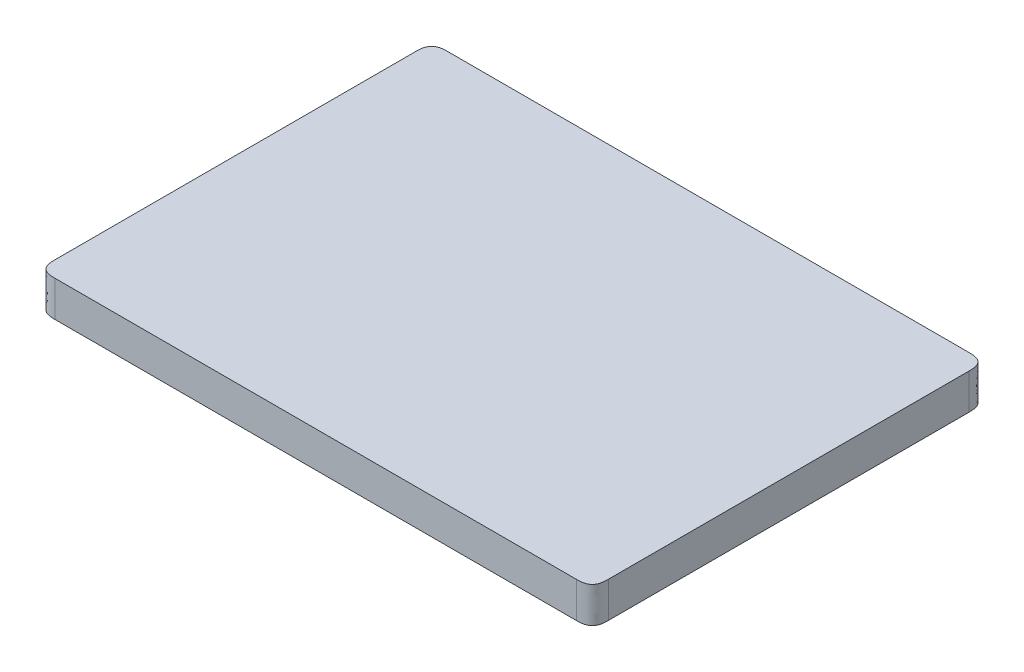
SolidWorks part; units mm, degrees
ref_plane "前视基准面" through (0, 0, 0) normal (0, 0, 1) x (1, 0, 0)
ref_plane "上视基准面" through (0, 0, 0) normal (0, 1, 0) x (1, 0, 0)
ref_plane "右视基准面" through (0, 0, 0) normal (1, 0, 0) x (0, 0, -1)
sketch "草图1" plane through (0, 0, 0) normal (0, 1, 0) x (1, 0, 0)
  line L1 (-155, -110) -> (155, -110)
  line L2 (-155, -110) -> (-155, 110)
  line L3 (-155, 110) -> (155, 110)
  line L4 (155, -110) -> (155, 110)
  line L5 (-155, -110) -> (155, 110) construction
  line L6 (-155, 110) -> (155, -110) construction
  point P0 (0, 0)
  dimension "D1" = 310
  dimension "D2" = 220
extrude "凸台-拉伸1" add sketch "草图1" along normal blind 20
fillet "圆角1" radius 9 4 edges at (-155, 10, -110) (155, 10, -110) (155, 10, 110) (-155, 10, 110)
